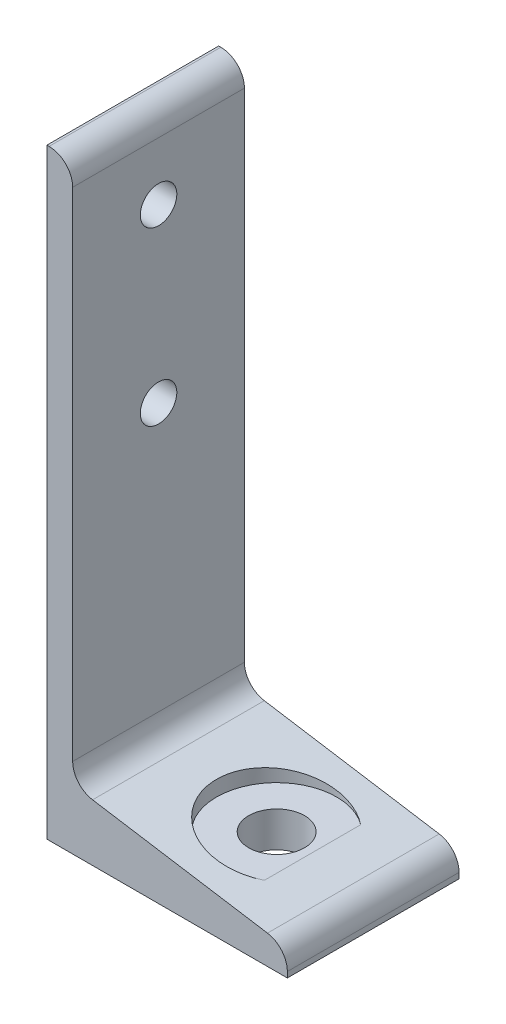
SolidWorks part; units mm, degrees
ref_plane "前视" through (0, 0, 0) normal (0, 0, 1) x (1, 0, 0)
ref_plane "上视" through (0, 0, 0) normal (0, 1, 0) x (1, 0, 0)
ref_plane "右视" through (0, 0, 0) normal (1, 0, 0) x (0, 0, -1)
sketch "草图1" plane through (0, 0, 0) normal (0, 0, 1) x (1, 0, 0)
  line L0 (0, 0) -> (0, -140)
  line L1 (0, -140) -> (56, -140)
  line L2 (56, -140) -> (56, -138.69)
  line L3 (0, 0) -> (0.5, 0)
  line L4 (6, -5.5) -> (6, -121.31)
  line L7 (51.3689, -133.259) -> (10.6311, -126.741)
  arc A0 (10.6311, -126.741) -> (6, -121.31) centre (11.5, -121.31) cw
  arc A1 (56, -138.69) -> (51.3689, -133.259) centre (50.5, -138.69) ccw
  arc A2 (6, -5.5) -> (0.5, 0) centre (0.5, -5.5) ccw
  dimension "D1" = 5.5
extrude "凸台-拉伸1" add sketch "草图1" along normal mid plane 40
sketch "草图2" plane through (0, 0, 0) normal (-1, 0, 0) x (0, 0, 1)
  line L0 (20, 0) -> (-20, 0) construction
  circle A0 centre (0, -19) radius 4.25
  circle A1 centre (0, -59) radius 4.25
  dimension "D1" = 8.5
  dimension "D2" = 8.5
  dimension "D3" = 19
  dimension "D4" = 59
extrude "切除-拉伸1" cut sketch "草图2" against normal blind 30
sketch "草图3" plane through (0, -140, 0) normal (0, -1, 0) x (1, 0, 0)
  line L0 (56, 20) -> (56, -20) construction
  circle A0 centre (33.5, 0) radius 6.5
  dimension "D1" = 13
  dimension "D2" = 22.5
extrude "切除-拉伸2" cut sketch "草图3" against normal blind 30
ref_plane "基准面1" through (0, -126.741, 0) normal (0, -1, 0) x (-1, 0, 0)
sketch "草图4" plane through (0, -126.741, 0) normal (0, -1, 0) x (-1, 0, 0)
  circle A0 centre (-33.5, 0) radius 14
  dimension "D1" = 28
extrude "切除-拉伸3" cut sketch "草图4" along normal blind 5
